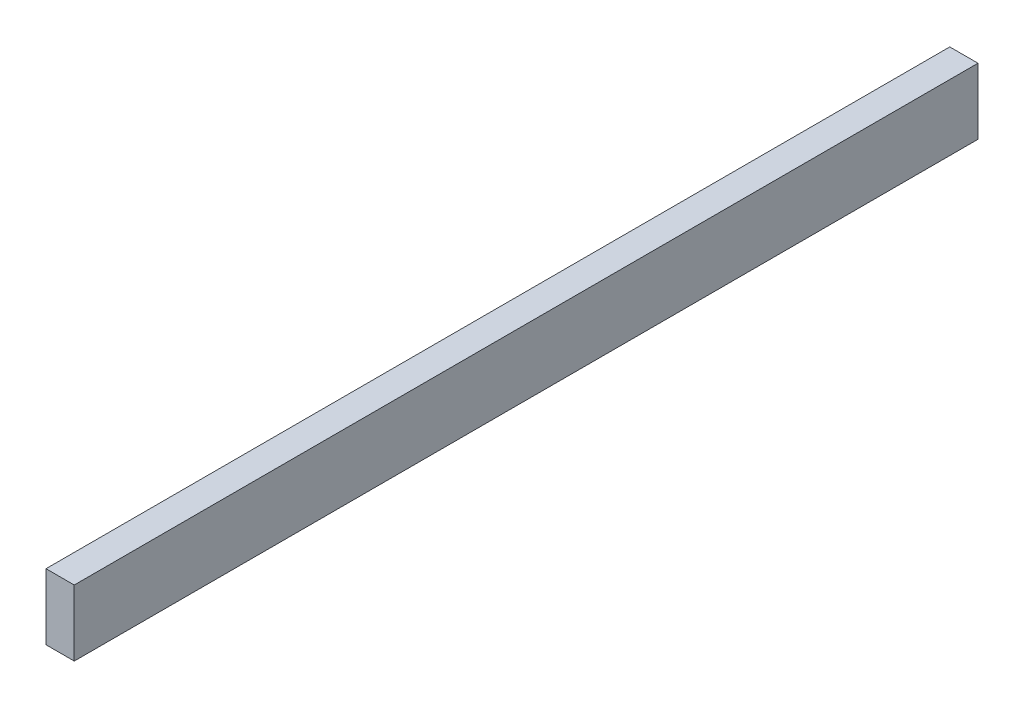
SolidWorks part; units mm, degrees
ref_plane "Front Plane" through (0, 0, 0) normal (0, 0, 1) x (1, 0, 0)
ref_plane "Top Plane" through (0, 0, 0) normal (0, 1, 0) x (1, 0, 0)
ref_plane "Right Plane" through (0, 0, 0) normal (1, 0, 0) x (0, 0, -1)
sketch "Sketch1" plane through (0, 0, 0) normal (0, 0, 1) x (1, 0, 0)
  line L1 (-19.05, -44.45) -> (19.05, -44.45)
  line L2 (-19.05, -44.45) -> (-19.05, 44.45)
  line L3 (-19.05, 44.45) -> (19.05, 44.45)
  line L4 (19.05, -44.45) -> (19.05, 44.45)
  line L5 (-19.05, -44.45) -> (19.05, 44.45) construction
  line L6 (-19.05, 44.45) -> (19.05, -44.45) construction
  point P0 (0, 0)
  dimension "D1" = 38.1
  dimension "D2" = 88.9
extrude "Boss-Extrude1" add sketch "Sketch1" along normal blind 1219.2
